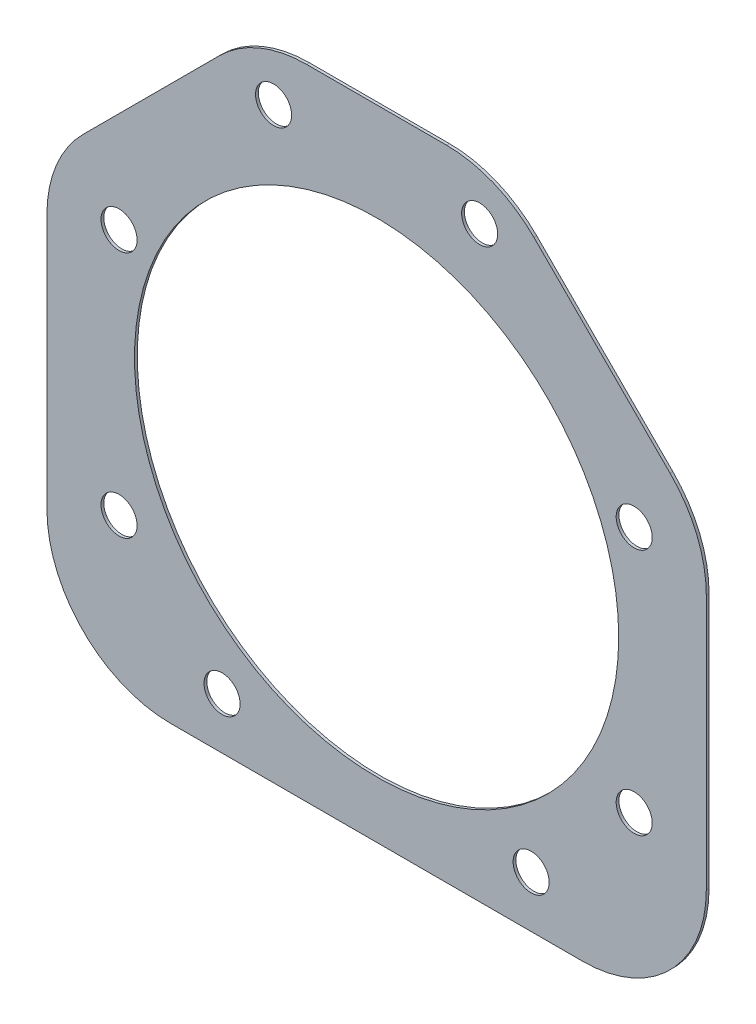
SolidWorks part; units mm, degrees
ref_plane "Face" through (0, 0, 0) normal (0, 0, 1) x (1, 0, 0)
ref_plane "Dessus" through (0, 0, 0) normal (0, 1, 0) x (1, 0, 0)
ref_plane "Droite" through (0, 0, 0) normal (1, 0, 0) x (0, 0, -1)
sketch "Esquisse1" plane through (0, 0, 0) normal (0, 0, 1) x (1, 0, 0)
  line L0 (-28.4853, 16.2721) -> (-15.2721, 29.4853)
  line L1 (15.2721, 29.4853) -> (28.4853, 16.2721)
  line L2 (32, 7.7868) -> (32, -17)
  line L3 (20, -29) -> (-20, -29)
  line L4 (-32, -17) -> (-32, 7.7868)
  line L5 (-6.7868, 33) -> (6.7868, 33)
  line L6 (0, 34.0488) -> (0, -33.4015) construction
  line L7 (-15.2721, 29.4853) -> (11.758, 56.5154) construction
  line L8 (15.2721, 29.4853) -> (-11.758, 56.5154) construction
  line L9 (0, 34.0488) -> (0, 56.5154) construction
  circle A0 centre (0, 0) radius 23.5
  arc A1 (-32, -17) -> (-20, -29) centre (-20, -17) ccw
  arc A2 (-28.4853, 16.2721) -> (-32, 7.7868) centre (-20, 7.7868) ccw
  arc A3 (-6.7868, 33) -> (-15.2721, 29.4853) centre (-6.7868, 21) ccw
  arc A4 (20, -29) -> (32, -17) centre (20, -17) ccw
  arc A5 (15.2721, 29.4853) -> (6.7868, 33) centre (6.7868, 21) ccw
  arc A6 (32, 7.7868) -> (28.4853, 16.2721) centre (20, 7.7868) ccw
  circle A7 centre (10, 28) radius 1.75
  circle A8 centre (-10, 28) radius 1.75
  circle A9 centre (25, 10) radius 1.75
  circle A10 centre (-25, 10) radius 1.75
  circle A11 centre (25, -14) radius 1.75
  circle A12 centre (-25, -14) radius 1.75
  circle A13 centre (15, -24) radius 1.75
  circle A14 centre (-15, -24) radius 1.75
  point P26 (0, 44.7574)
  point P27 (-10, 28)
  point P28 (10, 28)
  point P29 (-25, 10)
  point P30 (25, 10)
  point P31 (-15, -24)
  point P32 (15, -24)
  point P33 (-25, -14)
  point P34 (25, -14)
  dimension "D1" = 47
  dimension "D6" = 12
  dimension "D7" = 12
  dimension "D8" = 12
  dimension "D9" = 12
  dimension "D10" = 12
  dimension "D11" = 12
  dimension "D16" = 28
  dimension "D17" = 10
  dimension "D23" = 3.5
  dimension "D24" = 3.5
  dimension "D25" = 3.5
  dimension "D26" = 3.5
  dimension "D2" = 32
  dimension "D3" = 32
  dimension "D4" = 62
  dimension "D5" = 29
  dimension "D12" = 44.7574
  dimension "D13" = 10
  dimension "D14" = 45
  dimension "D15" = 45
  dimension "D18" = 14
  dimension "D19" = 25
  dimension "D20" = 15
  dimension "D21" = 24
  dimension "D22" = 25
extrude "Extrusion1" add sketch "Esquisse1" along normal blind 0.27
